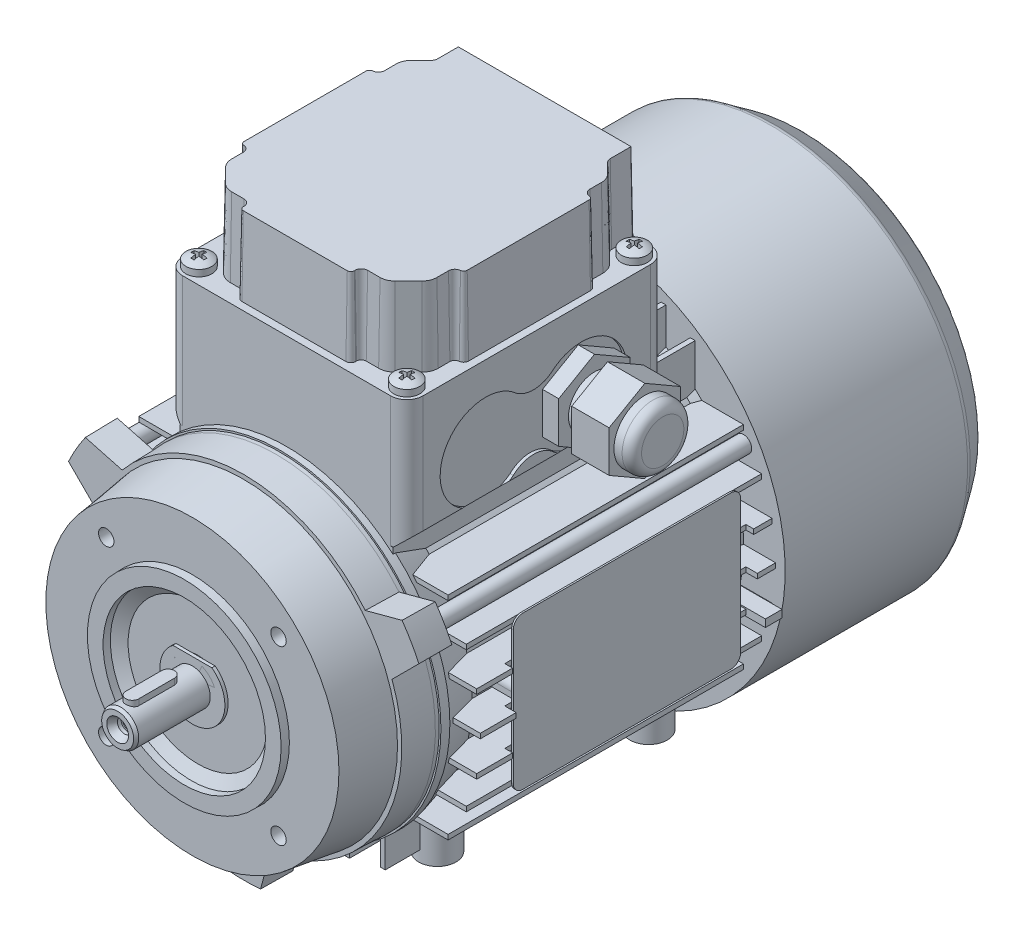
SolidWorks part; units mm, degrees
ref_plane "Front Plane" through (0, 0, 0) normal (0, 0, 1) x (1, 0, 0)
ref_plane "Top Plane" through (0, 0, 0) normal (0, 1, 0) x (1, 0, 0)
ref_plane "Right Plane" through (0, 0, 0) normal (1, 0, 0) x (0, 0, -1)
sketch "Sketch1" plane through (0, 0, 0) normal (0, 0, 1) x (1, 0, 0)
  line L0 (-6, 8) -> (6, 8)
  line L1 (0, 8) -> (0, 0) construction
  line L2 (0, 0) -> (-10, 0) construction
  line L3 (0, 0) -> (-7.0711, 7.0711) construction
  arc A0 (-6, 8) -> (6, 8) centre (0, 0) ccw
  dimension "D4" = 10
  dimension "D1" = 45
  dimension "D2" = 45
  dimension "D3" = 8
extrude "Boss-Extrude1" add sketch "Sketch1" along normal blind 1
imported_body "63"
imported_body "71" [suppressed]
imported_body "56" [suppressed]
imported_body "80" [suppressed]
